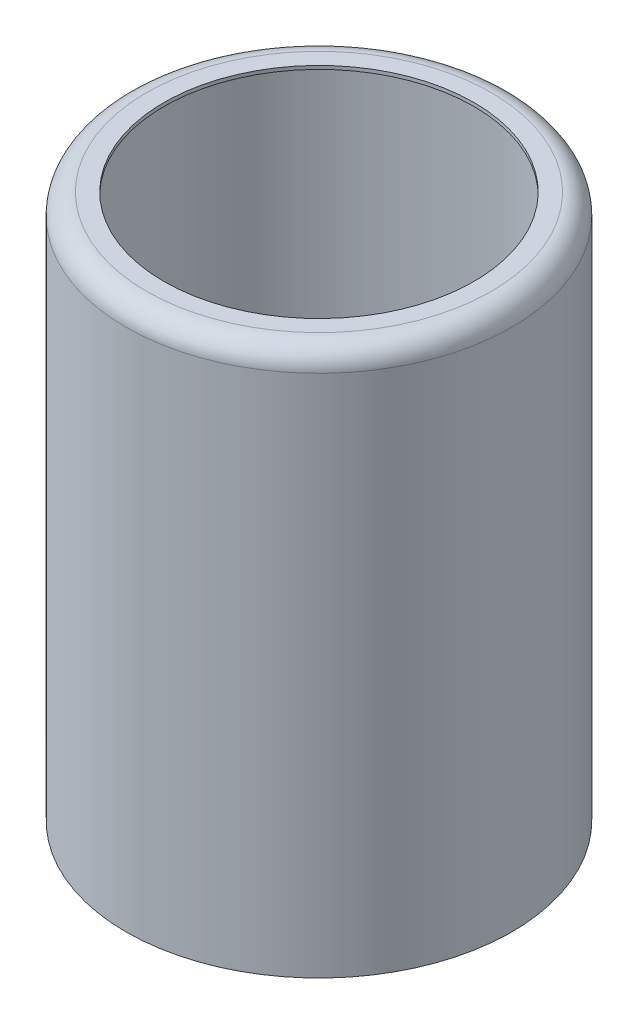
SolidWorks part; units mm, degrees
ref_plane "Face" through (0, 0, 0) normal (0, 0, 1) x (1, 0, 0)
ref_plane "Dessus" through (0, 0, 0) normal (0, 1, 0) x (1, 0, 0)
ref_plane "Droite" through (0, 0, 0) normal (1, 0, 0) x (0, 0, -1)
sketch "Esquisse1" plane through (0, 0, 0) normal (0, 0, 1) x (1, 0, 0)
  line L0 (0, 7.9828) -> (0, -20.4045) construction
  line L1 (5, 0) -> (4.5, 0)
  line L2 (5.5, -15.6) -> (5.5, -0.5)
  line L3 (5.5, -15.6) -> (4.5, -15.6)
  line L4 (5.6, -15.7) -> (4.5, -15.7)
  line L5 (5.6, -15.7) -> (5.6, -0.5)
  line L6 (5, 0.1) -> (4.5, 0.1)
  line L7 (4.5, 0.1) -> (4.5, 0)
  line L8 (4.5, -15.6) -> (4.5, -15.7)
  arc A0 (5, 0) -> (5.5, -0.5) centre (5, -0.5) cw
  arc A1 (5, 0.1) -> (5.6, -0.5) centre (5, -0.5) cw
  point P9 (5.5, 0)
  dimension "D3" = 0.5
  dimension "D1" = 15.6
  dimension "D2" = 5.5
  dimension "D4" = 0.5
  dimension "D5" = 1
  dimension "D6" = 0.1
revolve "Révolution1" add sketch "Esquisse1" angle 360 about L0
